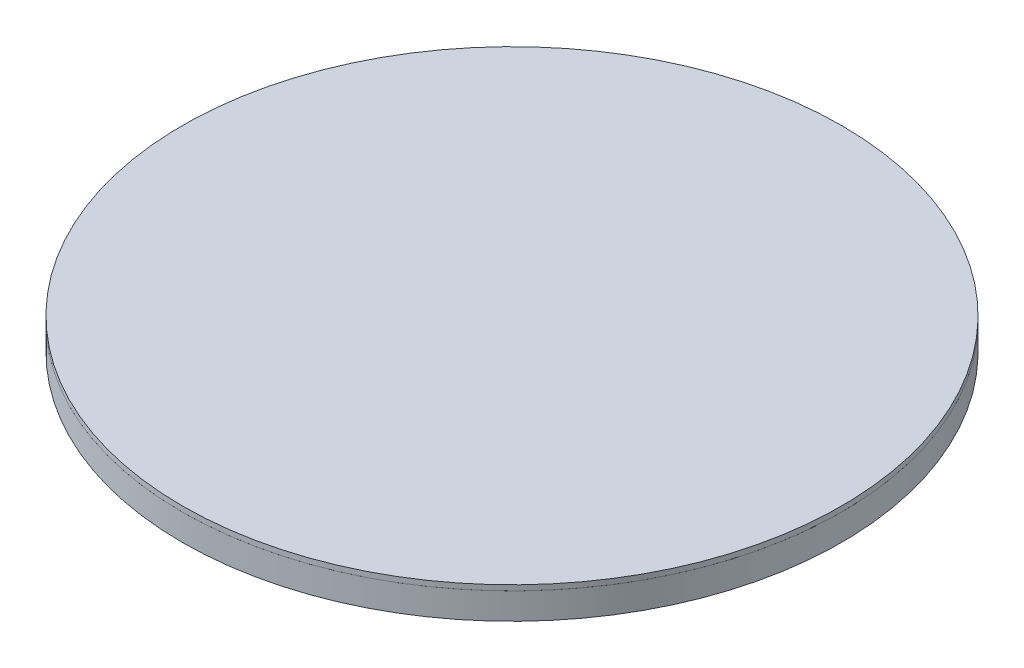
SolidWorks part; units mm, degrees
ref_plane "Front Plane" through (0, 0, 0) normal (0, 0, 1) x (1, 0, 0)
ref_plane "Top Plane" through (0, 0, 0) normal (0, 1, 0) x (1, 0, 0)
ref_plane "Right Plane" through (0, 0, 0) normal (1, 0, 0) x (0, 0, -1)
sketch "Sketch1" plane through (0, 0, 0) normal (0, 1, 0) x (1, 0, 0)
  circle A0 centre (0, 0) radius 12.5
  dimension "D1" = 25
extrude "Boss-Extrude1" add sketch "Sketch1" along normal blind 1.2
ref_plane "Plane1" through (0, 1, 0) normal (0, 1, 0) x (1, 0, 0)
sketch "Sketch3" plane through (0, 1, 0) normal (0, 1, 0) x (1, 0, 0)
  circle A0 centre (0, 0) radius 12.5
  circle A1 centre (0, 0) radius 12
  dimension "D1" = 25
  dimension "D2" = 24
extrude "Cut-Extrude1" cut sketch "Sketch3" against normal blind 0.001
